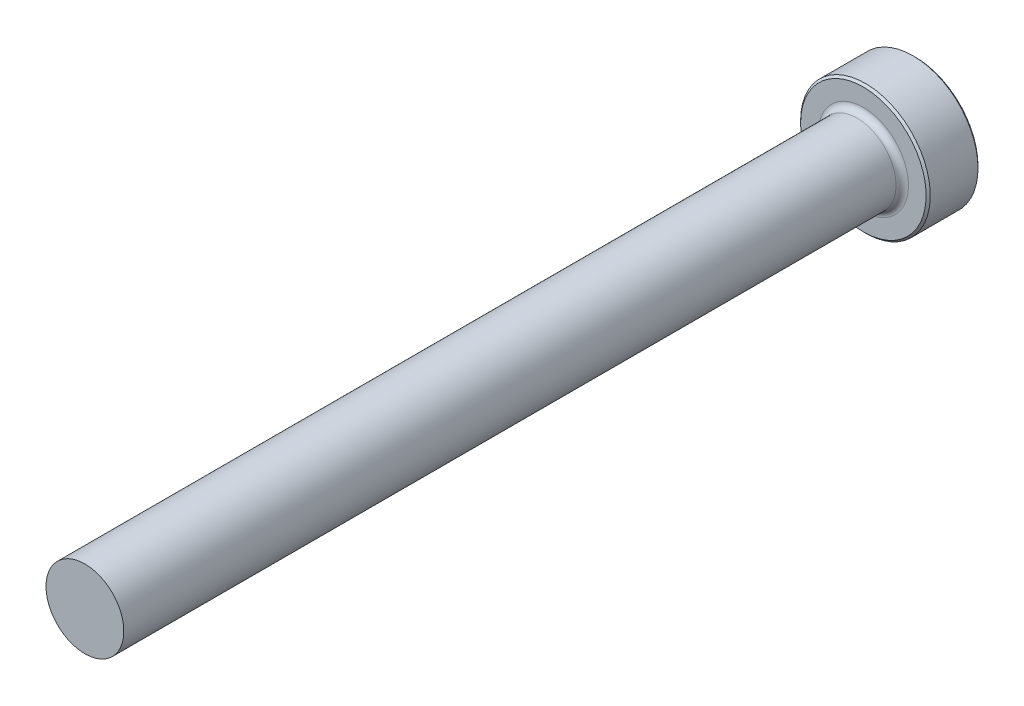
SolidWorks part; units mm, degrees
ref_plane "Front Plane" through (0, 0, 0) normal (0, 0, 1) x (1, 0, 0)
ref_plane "Top Plane" through (0, 0, 0) normal (0, 1, 0) x (1, 0, 0)
ref_plane "Right Plane" through (0, 0, 0) normal (1, 0, 0) x (0, 0, -1)
sketch "Sketch2" plane through (0, 0, 0) normal (1, 0, 0) x (0, 0, 1)
  line L0 (-2.1475, 0) -> (290.2977, 0) construction
  line L1 (101.6254, 0) -> (0, 0)
  line L2 (0, 0) -> (0, 7.9375)
  line L3 (0, 7.9375) -> (6.35, 7.9375)
  line L5 (6.35, 7.9375) -> (6.35, 5.5245)
  line L7 (7.112, 4.7625) -> (101.6254, 4.7625)
  line L8 (101.6254, 0) -> (101.6254, 4.7625)
  arc A0 (7.112, 4.7625) -> (6.35, 5.5245) centre (7.112, 5.5245) cw
  dimension "D5" = 0.762
  dimension "D1" = 15.875
  dimension "D2" = 6.35
  dimension "D3" = 9.525
  dimension "D4" = 101.6254
revolve "Revolve1" add sketch "Sketch2" angle 360 about L0
chamfer "Chamfer1" distance 0.254 angle 45 2 edges at (-7.9375, 0, 0) (-7.9375, 0, 6.35)
